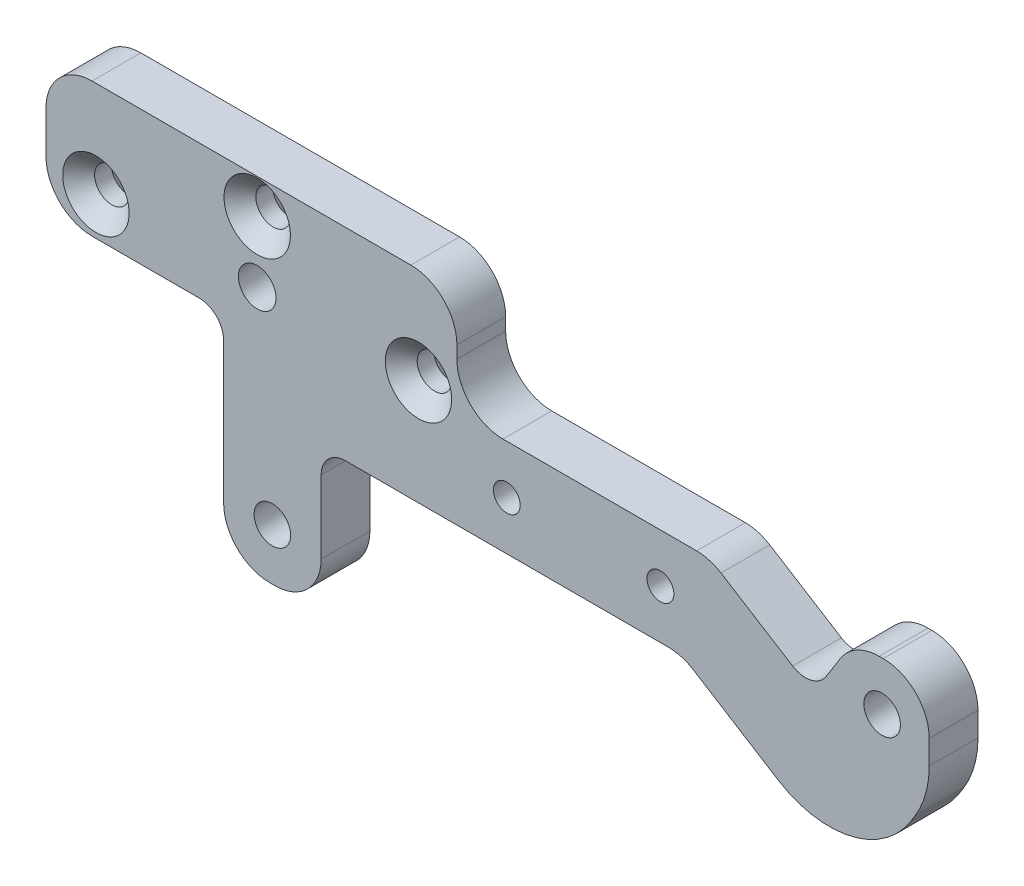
SolidWorks part; units mm, degrees
ref_plane "Front Plane" through (0, 0, 0) normal (0, 0, 1) x (1, 0, 0)
ref_plane "Top Plane" through (0, 0, 0) normal (0, 1, 0) x (1, 0, 0)
ref_plane "Right Plane" through (0, 0, 0) normal (1, 0, 0) x (0, 0, -1)
sketch "Sketch1" plane through (0, 0, 0) normal (0, 0, 1) x (1, 0, 0)
  line L1 (-55, 25) -> (175, 25)
  line L2 (-55, 25) -> (-55, -65)
  line L3 (-55, -65) -> (175, -65)
  line L4 (175, 25) -> (175, -65)
  dimension "D1" = 25
  dimension "D2" = 65
  dimension "D3" = 55
  dimension "D4" = 175
extrude "Boss-Extrude1" add sketch "Sketch1" along normal blind 12.7
sketch "Sketch2" plane through (0, 0, 12.7) normal (0, 0, 1) x (1, 0, 0)
  circle A0 centre (0, 0) radius 4.9
  dimension "D1" = 9.8
extrude "Cut-Extrude1" cut sketch "Sketch2" against normal through all
hole_wizard "CSK for M8 Flat Head Machine Screw1" positions "Sketch4" profile "Sketch3" countersink size "M8" standard "Ansi Metric"
sketch "Sketch4" plane through (0, 0, 12.7) normal (0, 0, 1) x (1, 0, 0)
  point P0 (-42, 0)
  point P1 (0, 16)
  point P3 (42, 0)
  dimension "D1" = 16
  dimension "D2" = 42
  dimension "D3" = 42
  dimension "D4" = 0
sketch "Sketch3" plane through (-42, 0, 12.7) normal (1, 0, 0) x (0, -1, 0)
  line L0 (0, 0) -> (0, 12.7)
  line L1 (0, 12.7) -> (4.5, 12.7)
  line L2 (4.5, 12.7) -> (4.5, 4.15)
  line L3 (4.5, 4.15) -> (8.65, 0)
  line L5 (8.65, 0) -> (0, 0)
  line L6 (-4.5, 4.15) -> (-8.65, 0) construction
  line L11 (0, -6.35) -> (0, 107.95) construction
  dimension "Thru Hole Dia." = 9
  dimension "Thru Hole Depth" = 12.7
  dimension "Near C'Sink Dia." = 17.3
  dimension "Near C'Sink Angle" = 90
sketch "Sketch5" plane through (0, 0, 12.7) normal (0, 0, 1) x (1, 0, 0)
  circle A0 centre (162.72, -14.94) radius 4.7625
  dimension "D3" = 9.525
  dimension "D1" = 14.94
  dimension "D2" = 162.72
extrude "Cut-Extrude2" cut sketch "Sketch5" against normal through all
sketch "Sketch6" plane through (0, 0, 12.7) normal (0, 0, 1) x (1, 0, 0)
  circle A0 centre (3.95, -51.6) radius 4.7625
  dimension "D3" = 9.525
  dimension "D1" = 3.95
  dimension "D2" = 51.6
extrude "Cut-Extrude3" cut sketch "Sketch6" against normal through all
sketch "Sketch7" plane through (0, 0, 12.7) normal (0, 0, 1) x (1, 0, 0)
  line L1 (-55, -65) -> (-8.75, -65)
  line L2 (-55, -65) -> (-55, -10)
  line L3 (-55, -10) -> (-8.75, -10)
  line L4 (-8.75, -65) -> (-8.75, -10)
  line L5 (175, 25) -> (52, 25)
  line L6 (175, 25) -> (175, -2.24)
  line L7 (175, -2.24) -> (52, -2.24)
  line L8 (52, 25) -> (52, -2.24)
  line L9 (175, -65) -> (16.65, -65)
  line L10 (175, -65) -> (175, -27.64)
  line L11 (175, -27.64) -> (16.65, -27.64)
  line L12 (16.65, -65) -> (16.65, -27.64)
  circle A0 centre (3.95, -51.6) radius 4.7625 construction
  circle A1 centre (162.72, -14.94) radius 4.7625 construction
  circle A2 centre (42, 0) radius 4.5 construction
  circle A3 centre (-42, 0) radius 4.5 construction
  dimension "D1" = 12.7
  dimension "D2" = 12.7
  dimension "D3" = 12.7
  dimension "D4" = 12.7
  dimension "D5" = 10
  dimension "D6" = 10
extrude "Cut-Extrude4" cut sketch "Sketch7" against normal through all
sketch "Sketch11" plane through (0, 0, 12.7) normal (0, 0, 1) x (1, 0, 0)
  line L0 (155.3265, -2.24) -> (144.8064, -19.0757)
  line L1 (52, -2.24) -> (175, -2.24) construction
  line L2 (144.8064, -19.0757) -> (117.8637, -2.24)
  line L3 (117.8637, -2.24) -> (155.3265, -2.24)
  circle A0 centre (162.72, -14.94) radius 4.7625 construction
  dimension "D1" = 58
  dimension "D2" = 13
  dimension "D3" = 13
extrude "Cut-Extrude6" cut sketch "Sketch11" against normal through all
sketch "Sketch13" plane through (0, 0, 0) normal (0, 0, 1) x (1, 0, 0)
  line L0 (110.5804, -27.64) -> (156.91, -56.59)
  line L2 (175, -27.64) -> (16.65, -27.64) construction
  line L4 (156.91, -56.59) -> (175, -27.64)
  line L5 (175, -27.64) -> (110.5804, -27.64)
  line L6 (117.8637, -2.24) -> (144.8064, -19.0757) construction
  line L7 (117.8637, -2.24) -> (144.8064, -19.0757) construction
  line L8 (144.8064, -19.0757) -> (155.3265, -2.24) construction
  dimension "D1" = 25.4
extrude "Boss-Extrude2" add sketch "Sketch13" along normal up to surface (12.7 mm away)
fillet "Fillet2" radius 12 9 edges at (-55, -10, 6.35) (-8.75, -65, 6.35) (16.65, -65, 6.35) (175, -2.24, 6.35) (155.3265, -2.24, 6.35) (117.8637, -2.24, 6.35) (52, -2.24, 6.35) (52, 25, 6.35) (-55, 25, 6.35)
fillet "Fillet3" radius 6.35 3 edges at (144.8064, -19.0757, 6.35) (-8.75, -10, 6.35) (16.65, -27.64, 6.35)
fillet "Fillet6" radius 25 2 edges at (156.91, -56.59, 6.35) (175, -27.64, 6.35)
fillet "Fillet7" radius 12 1 edges at (110.5804, -27.64, 6.35)
hole_wizard "M8x1.0 Tapped Hole1" positions "Sketch15" profile "Sketch14" tap size "M8x1.0" standard "AS"
sketch "Sketch15" plane through (0, 0, 12.7) normal (0, 0, 1) x (1, 0, 0)
  line L0 (64, -2.24) -> (114.4228, -2.24) construction
  circle A0 centre (42, 0) radius 4.5 construction
  point P0 (65, -14.94)
  point P1 (105, -14.94)
  dimension "D1" = 23
  dimension "D2" = 40
  dimension "D3" = 12.7
sketch "Sketch14" plane through (65, -14.94, 12.7) normal (1, 0, 0) x (0, -1, 0)
  line L0 (0, 0) -> (0, 12.7)
  line L1 (0, 12.7) -> (3.5, 12.7)
  line L2 (3.5, 12.7) -> (3.5, 0)
  line L5 (3.5, 0) -> (0, 0)
  line L11 (0, -6.35) -> (0, 107.95) construction
  dimension "Thru Tap Drill Dia." = 7
  dimension "Thru Tap Drill Depth" = 12.7
chamfer "Chamfer2" distance 4.15 angle 45 3 edges at (46.5, 0, 0) (4.5, 16, 0) (-37.5, 0, 0)
